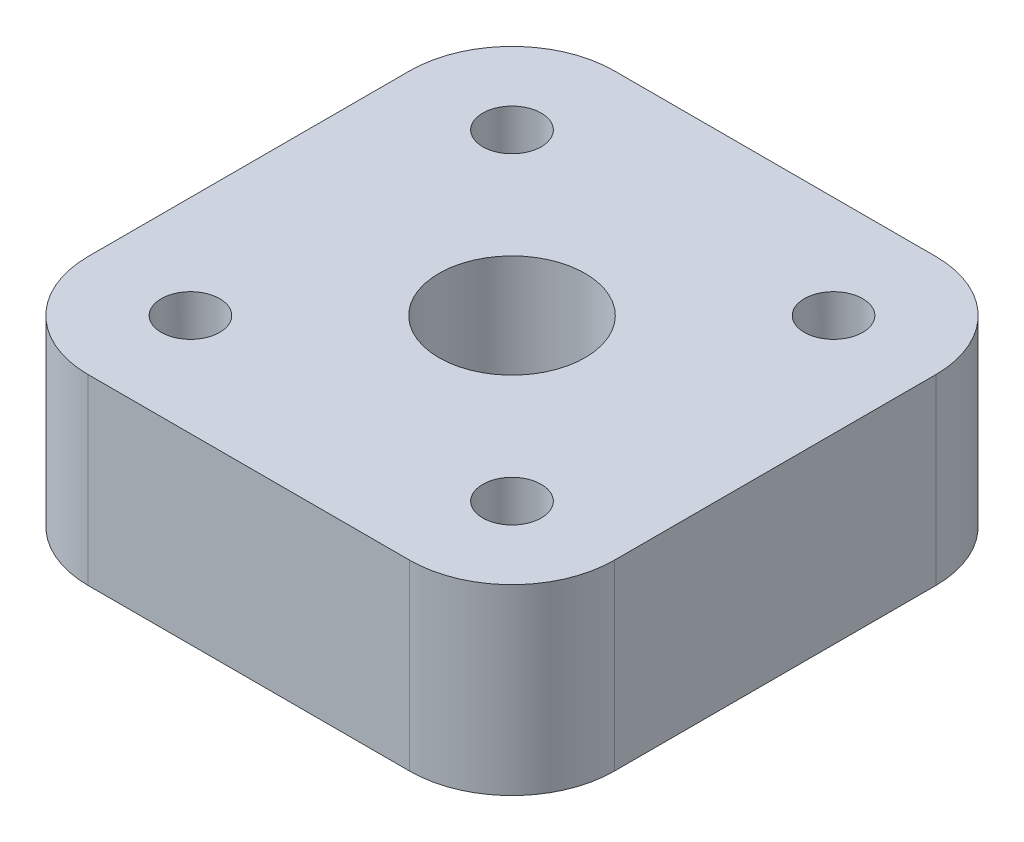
SolidWorks part; units mm, degrees
ref_plane "Front Plane" through (0, 0, 0) normal (0, 0, 1) x (1, 0, 0)
ref_plane "Top Plane" through (0, 0, 0) normal (0, 1, 0) x (1, 0, 0)
ref_plane "Right Plane" through (0, 0, 0) normal (1, 0, 0) x (0, 0, -1)
sketch "Sketch1" plane through (0, 0, 0) normal (0, 1, 0) x (1, 0, 0)
  line L0 (-1000, 0) -> (49000, 0) construction
  line L1 (-18, 18) -> (18, 18)
  line L2 (-18, 18) -> (-18, -18)
  line L3 (-18, -18) -> (18, -18)
  line L4 (18, 18) -> (18, -18)
  line L5 (-18, 18) -> (18, -18) construction
  line L6 (-18, -18) -> (18, 18) construction
  line L7 (0, -1000) -> (0, 49000) construction
  circle A0 centre (0, 0) radius 5
  circle A1 centre (11, -11) radius 2
  circle A2 centre (11, 11) radius 2
  circle A3 centre (-11, 11) radius 2
  circle A4 centre (-11, -11) radius 2
  point P0 (0, 0)
  dimension "D2" = 4
  dimension "D3" = 22
  dimension "D4" = 22
  dimension "D5" = 10
  dimension "D1" = 36
extrude "Boss-Extrude1" add sketch "Sketch1" along normal mid plane 12.5
fillet "Fillet1" radius 7 4 edges at (18, 0, -18) (-18, 0, -18) (-18, 0, 18) (18, 0, 18)
sketch "Sketch2" plane through (0, -6.25, 0) normal (0, -1, 0) x (1, 0, 0)
  circle A0 centre (-11, 11) radius 3.5
  circle A1 centre (11, 11) radius 3.5
  circle A2 centre (-11, -11) radius 3.5
  circle A3 centre (11, -11) radius 3.5
  dimension "D1" = 7
extrude "Cut-Extrude1" cut sketch "Sketch2" against normal blind 4
